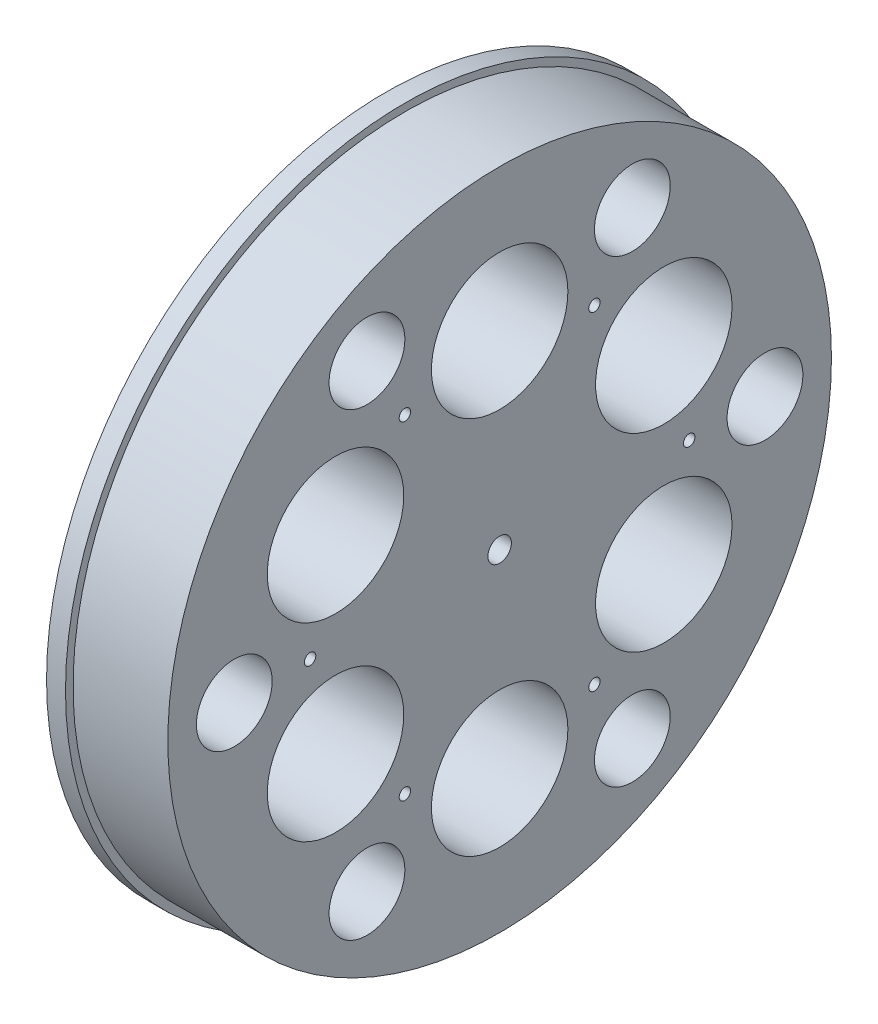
SolidWorks part; units mm, degrees
ref_plane "Plan de face" through (0, 0, 0) normal (0, 0, 1) x (1, 0, 0)
ref_plane "Plan de dessus" through (0, 0, 0) normal (0, 1, 0) x (1, 0, 0)
ref_plane "Plan de droite" through (0, 0, 0) normal (1, 0, 0) x (0, 0, -1)
sketch "Esquisse1" plane through (0, 0, 0) normal (1, 0, 0) x (0, 0, -1)
  line L0 (-30.0872, 0) -> (317.3434, 0) construction
  line L2 (290, 145.6709) -> (290, -16.7788) construction
  circle A0 centre (290, 0) radius 87.535 construction
  circle A1 centre (290, 0) radius 12 construction
  circle A2 centre (290, 0) radius 50 construction
  circle A3 centre (290, 50) radius 18
  circle A4 centre (290, 0) radius 89.535
  circle A5 centre (290, 0) radius 70 construction
  circle A6 centre (220, 0) radius 10
  circle A7 centre (255, 60.6218) radius 10
  circle A8 centre (325, 60.6218) radius 10
  circle A9 centre (240, 0) radius 1.5
  circle A10 centre (290, 0) radius 92.535 construction
  circle A11 centre (290, 0) radius 3.1
  circle A12 centre (360, 0) radius 10
  circle A13 centre (325, -60.6218) radius 10
  circle A14 centre (255, -60.6218) radius 10
  circle A18 centre (333.3013, 25) radius 18
  circle A19 centre (265, 43.3013) radius 1.5
  circle A20 centre (333.3013, -25) radius 18
  circle A21 centre (315, 43.3013) radius 1.5
  circle A22 centre (290, -50) radius 18
  circle A23 centre (340, 0) radius 1.5
  circle A24 centre (246.6987, -25) radius 18
  circle A25 centre (315, -43.3013) radius 1.5
  circle A26 centre (246.6987, 25) radius 18
  circle A27 centre (265, -43.3013) radius 1.5
  dimension "D2" = 6
  dimension "D1" = 6
extrude "Boss.-Extru.1" add sketch "Esquisse1" along normal blind 30
sketch "Esquisse2" plane through (30, 0, 0) normal (1, 0, 0) x (0, 0, -1)
  circle A0 centre (290, 0) radius 87.535
  circle A1 centre (290, 0) radius 92.1598
extrude "Enlèv. mat.-Extru.1" cut sketch "Esquisse2" against normal blind 25
